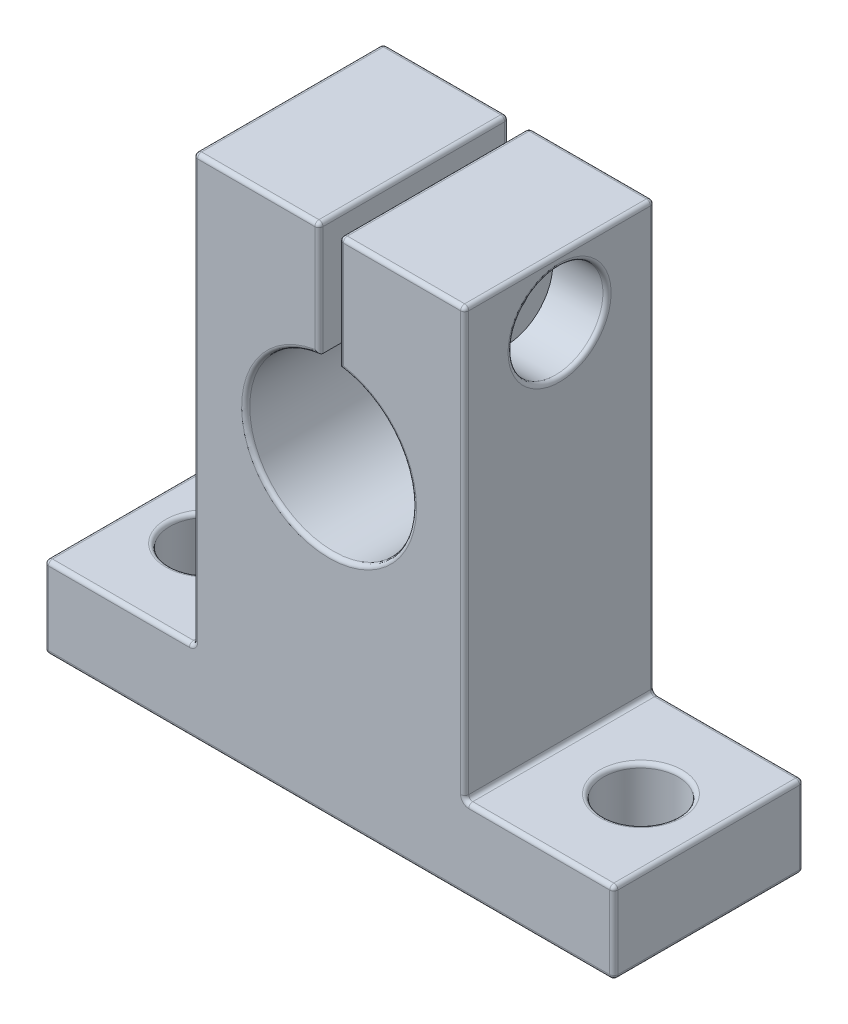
SolidWorks part; units mm, degrees
ref_plane "Alzado" through (0, 0, 0) normal (0, 0, 1) x (1, 0, 0)
ref_plane "Planta" through (0, 0, 0) normal (0, 1, 0) x (1, 0, 0)
ref_plane "Vista lateral" through (0, 0, 0) normal (1, 0, 0) x (0, 0, -1)
imported_body "Sólido importado3"
sketch "Croquis1" plane through (11, 0, 0) normal (-1, 0, 0) x (0, 0, 1)
  line L0 (4.5615, 0) -> (4.5615, 30.9606)
  line L1 (4.5615, 30.9606) -> (14, 30.9606)
  line L2 (14, 30.9606) -> (14, 0)
  line L3 (14, 0) -> (4.5615, 0)
extrude "Saliente-Extruir1" add sketch "Croquis1" along normal blind 11
sketch "Croquis2" plane through (0, 35.5405, 0) normal (0, 1, 0) x (-1, 0, 0)
  line L0 (-11, 4.5615) -> (-20.25, 4.5615)
  line L1 (-20.25, 4.5615) -> (-20.25, 14)
  line L2 (-20.25, 14) -> (-11, 14)
  line L3 (-11, 14) -> (-11, 4.5615)
extrude "Saliente-Extruir2" add sketch "Croquis2" along normal blind 1.9595
sketch "Croquis3" plane through (0, 0, 4.5615) normal (0, 0, -1) x (-1, 0, 0)
  line L0 (-20.25, 29.1041) -> (-20.25, 37.5)
  line L1 (-20.25, 37.5) -> (-11, 37.5)
  line L2 (-11, 37.5) -> (-11, 30.9606)
  line L3 (-11, 30.9606) -> (0, 30.9606)
  line L4 (0, 30.9606) -> (0, 0)
  line L5 (0, 0) -> (-42, 0)
  line L6 (-42, 0) -> (-42, 37.5)
  line L7 (-42, 37.5) -> (-21.75, 37.5)
  line L8 (-21.75, 37.5) -> (-21.75, 29.1041)
  arc A0 (-21.75, 29.1041) -> (-20.25, 29.1041) centre (-21, 23) cw
extrude "Saliente-Extruir3" add sketch "Croquis3" along normal blind 4.5615
sketch "Croquis4" plane through (0, 30.9606, 0) normal (0, 1, 0) x (-1, 0, 0)
  line L0 (0, 0) -> (0, 14)
  line L1 (0, 14) -> (-11, 14)
  line L2 (-11, 14) -> (-11, 0)
  line L3 (-11, 0) -> (0, 0)
extrude "Cortar-Extruir1" cut sketch "Croquis4" against normal blind 24.9606
sketch "Croquis5" plane through (0, 0, 0) normal (0, 0, -1) x (-1, 0, 0)
  line L0 (-42, 6) -> (-31, 6)
  line L1 (-31, 6) -> (-31, 37.5)
  line L2 (-31, 37.5) -> (-42, 37.5)
  line L3 (-42, 37.5) -> (-42, 6)
extrude "Cortar-Extruir2" cut sketch "Croquis5" against normal through all
ref_plane "Plano1" through (0, 0, 7) normal (0, 0, 1) x (1, 0, 0)
sketch "Croquis6" plane through (0, 0, 7) normal (0, 0, 1) x (1, 0, 0)
  line L0 (21.75, 35.1) -> (21.75, 33.1)
  line L1 (21.75, 33.1) -> (31, 33.1)
  line L2 (31, 33.1) -> (31, 36.6)
  line L3 (31, 36.6) -> (27, 36.6)
  line L4 (27, 36.6) -> (27, 35.1)
  line L5 (27, 35.1) -> (21.75, 35.1)
  line L6 (21.75, 33.1) -> (31, 33.1) construction
revolve "Cortar-Revolución1" cut sketch "Croquis6" angle 360 about L6
ref_plane "Plano2" through (0, 23, 0) normal (0, 1, 0) x (1, 0, 0)
sketch "Croquis7" plane through (0, 23, 0) normal (0, 1, 0) x (1, 0, 0)
  line L0 (27.15, 0) -> (21, 0)
  line L1 (21, 0) -> (21, -14)
  line L2 (21, -14) -> (27.15, -14)
  line L3 (27.15, -14) -> (27.15, 0)
  line L4 (21, 0) -> (21, -14) construction
revolve "Cortar-Revolución2" cut sketch "Croquis7" angle 360 about L4
ref_plane "Plano3" through (0, 0, 7) normal (0, 0, -1) x (-1, 0, 0)
sketch "Croquis8" plane through (0, 0, 7) normal (0, 0, -1) x (-1, 0, 0)
  line L0 (-20.25, 35.1) -> (-20.25, 33.1)
  line L1 (-20.25, 33.1) -> (-11, 33.1)
  line L2 (-11, 33.1) -> (-11, 35.1)
  line L3 (-11, 35.1) -> (-20.25, 35.1)
  line L4 (-20.25, 33.1) -> (-11, 33.1) construction
revolve "Cortar-Revolución3" cut sketch "Croquis8" angle 360 about L4
hole_wizard "Diámetro de taladro Ø5.5 (5.5)1" positions "Croquis10" profile "Croquis9" hole size "Ø5.5" standard "Ansi Metric"
sketch "Croquis10" plane through (0, 0, 0) normal (0, -1, 0) x (-1, 0, 0)
  point P0 (-5, -7)
  point P1 (-37, -7)
sketch "Croquis9" plane through (5, 0, 7) normal (1, 0, 0) x (0, 0, -1)
  line L0 (0, 0) -> (0, 37.5)
  line L1 (0, 37.5) -> (2.75, 37.5)
  line L2 (2.75, 37.5) -> (2.75, 0)
  line L5 (2.75, 0) -> (0, 0)
  line L11 (0, -6.35) -> (0, 107.95) construction
  dimension "Diámetro de taladro hasta el siguiente" = 5.5
  dimension "Profundidad de taladro hasta el siguiente" = 37.5
fillet "Redondeo1" radius 0.3 39 edges at (21, 0, 14) (42, 0, 7) (21.75, 37.5, 7) (21.75, 33.302, 14) (20.25, 33.302, 14) (11, 21.75, 14) (0, 0, 7) (0, 3, 14) (11, 37.5, 7) (15.625, 37.5, 14) (20.25, 37.5, 7) (21.75, 33.302, 0) (26.375, 37.5, 0) (21, 0, 0) (0, 3, 0) (11, 21.75, 0) (15.625, 37.5, 0) (20.25, 33.302, 0) (5.5, 6, 0) (11, 6, 7) (5.5, 6, 14) (0, 6, 7) (42, 3, 0) (42, 3, 14) (26.375, 37.5, 14) (42, 6, 7) (31, 21.75, 14) (31, 37.5, 7) (36.5, 6, 14) (31, 6, 7) (36.5, 6, 0) (31, 21.75, 0) (31, 33.1, 3.5) (21, 16.85, 0) (21, 16.85, 14) (37, 6, 4.25) (37, 0, 4.25) (5, 6, 9.75) (5, 0, 4.25)
